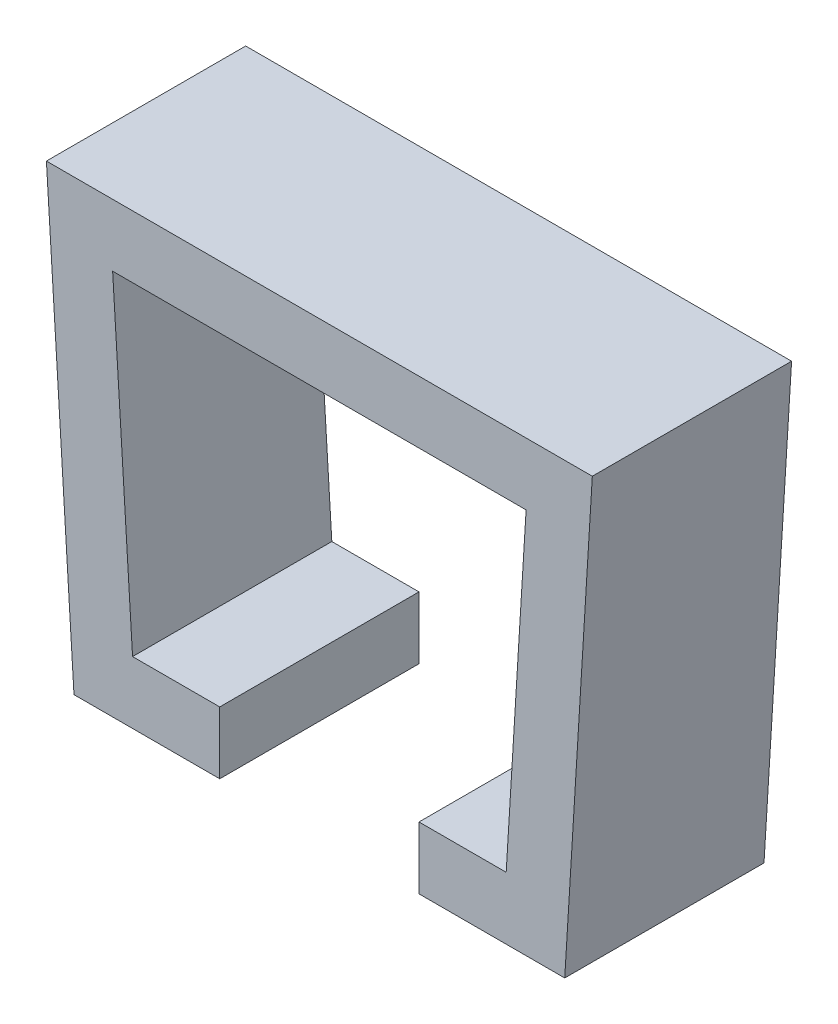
SolidWorks part; units mm, degrees
ref_plane "Plan de face" through (0, 0, 0) normal (0, 0, 1) x (1, 0, 0)
ref_plane "Plan de dessus" through (0, 0, 0) normal (0, 1, 0) x (1, 0, 0)
ref_plane "Plan de droite" through (0, 0, 0) normal (1, 0, 0) x (0, 0, -1)
sketch "Esquisse1" plane through (0, 0, 0) normal (0, 0, 1) x (1, 0, 0)
  line L0 (0, 0) -> (0, 7.0312) construction
  line L1 (-3.75, 0) -> (-4.15, 6.5)
  line L2 (-4.15, 6.5) -> (4.15, 6.5)
  line L3 (3.75, 0) -> (4.15, 6.5)
  line L4 (-3.75, 0) -> (-2, 0)
  line L5 (3.75, 0) -> (2, 0)
  line L6 (-4.9254, -1.25) -> (-2, -1.25)
  line L7 (-4.9254, -1.25) -> (-5.4793, 7.75)
  line L8 (-5.4793, 7.75) -> (5.4793, 7.75)
  line L9 (4.9254, -1.25) -> (5.4793, 7.75)
  line L10 (4.9254, -1.25) -> (2, -1.25)
  line L11 (-2, 0) -> (-2, -1.25)
  line L12 (2, 0) -> (2, -1.25)
  point P7 (0, 6.5)
  dimension "D1" = 7.5
  dimension "D2" = 1.75
  dimension "D3" = 6.5
  dimension "D5" = 0.4
  dimension "D4" = 1.25
extrude "Boss.-Extru.1" add sketch "Esquisse1" along normal blind 4
